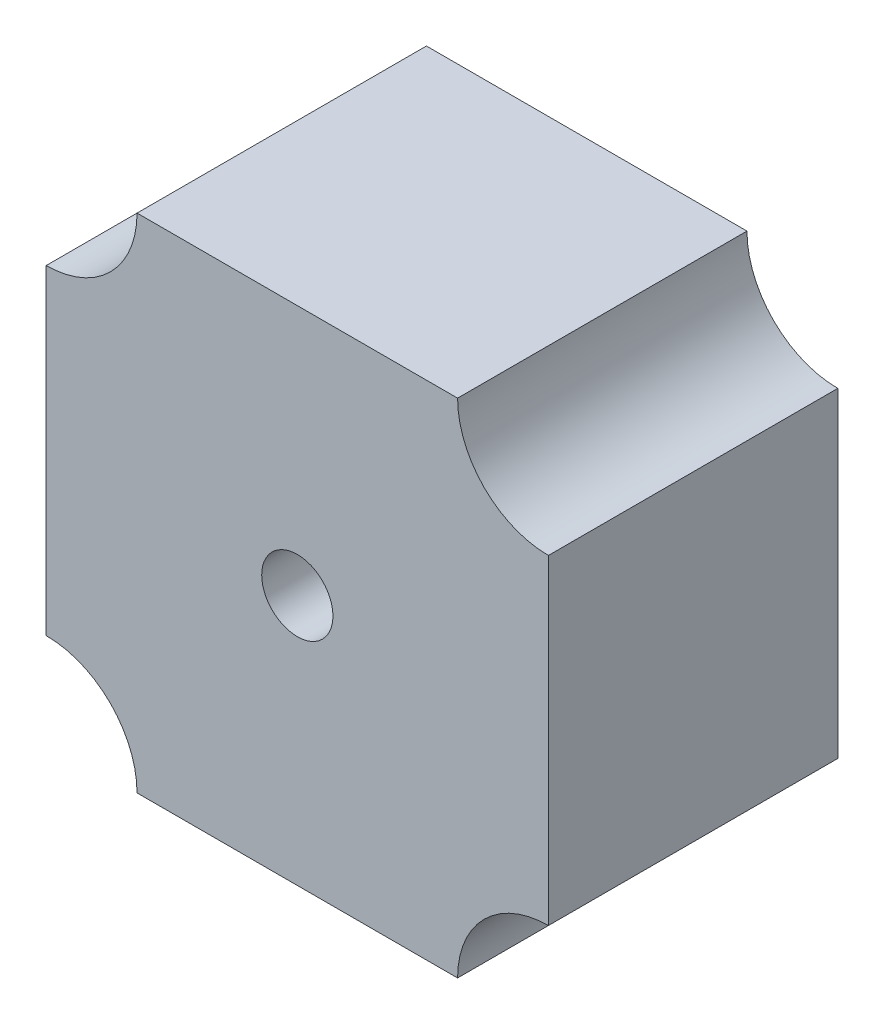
SolidWorks part; units mm, degrees
ref_plane "前视" through (0, 0, 0) normal (0, 0, 1) x (1, 0, 0)
ref_plane "上视" through (0, 0, 0) normal (0, 1, 0) x (1, 0, 0)
ref_plane "右视" through (0, 0, 0) normal (1, 0, 0) x (0, 0, -1)
sketch "草图2" plane through (0, 0, 0) normal (0, 0, 1) x (1, 0, 0)
  line L1 (18, -28.2) -> (-18, -28.2)
  line L2 (28.2, -18) -> (28.2, 18)
  line L3 (18, 28.2) -> (-18, 28.2)
  line L4 (-28.2, -18) -> (-28.2, 18)
  line L5 (28.2, -28.2) -> (-28.2, 28.2) construction
  line L6 (28.2, 28.2) -> (-28.2, -28.2) construction
  line L11 (28.2, -18) -> (-28.2, 18) construction
  line L12 (28.2, 18) -> (-28.2, -18) construction
  line L17 (18, -28.2) -> (-18, 28.2) construction
  line L18 (18, 28.2) -> (-18, -28.2) construction
  arc A0 (-28.2, 18) -> (-18, 28.2) centre (-28.2, 28.2) ccw
  arc A1 (18, 28.2) -> (28.2, 18) centre (28.2, 28.2) ccw
  arc A2 (-28.2, -18) -> (-18, -28.2) centre (-28.2, -28.2) cw
  arc A3 (18, -28.2) -> (28.2, -18) centre (28.2, -28.2) cw
  point P0 (0, 0)
  point P6 (0, 0)
  point P11 (0, 0)
  dimension "D1" = 56.4
  dimension "D2" = 56.4
  dimension "D3" = 36
  dimension "D4" = 36
extrude "凸台-拉伸1" add sketch "草图2" along normal blind 32.5
sketch "草图3" plane through (0, 0, 0) normal (0, 0, -1) x (-1, 0, 0)
  circle A0 centre (0, 0) radius 4
extrude "切除-拉伸1" cut sketch "草图3" against normal blind 32.5
